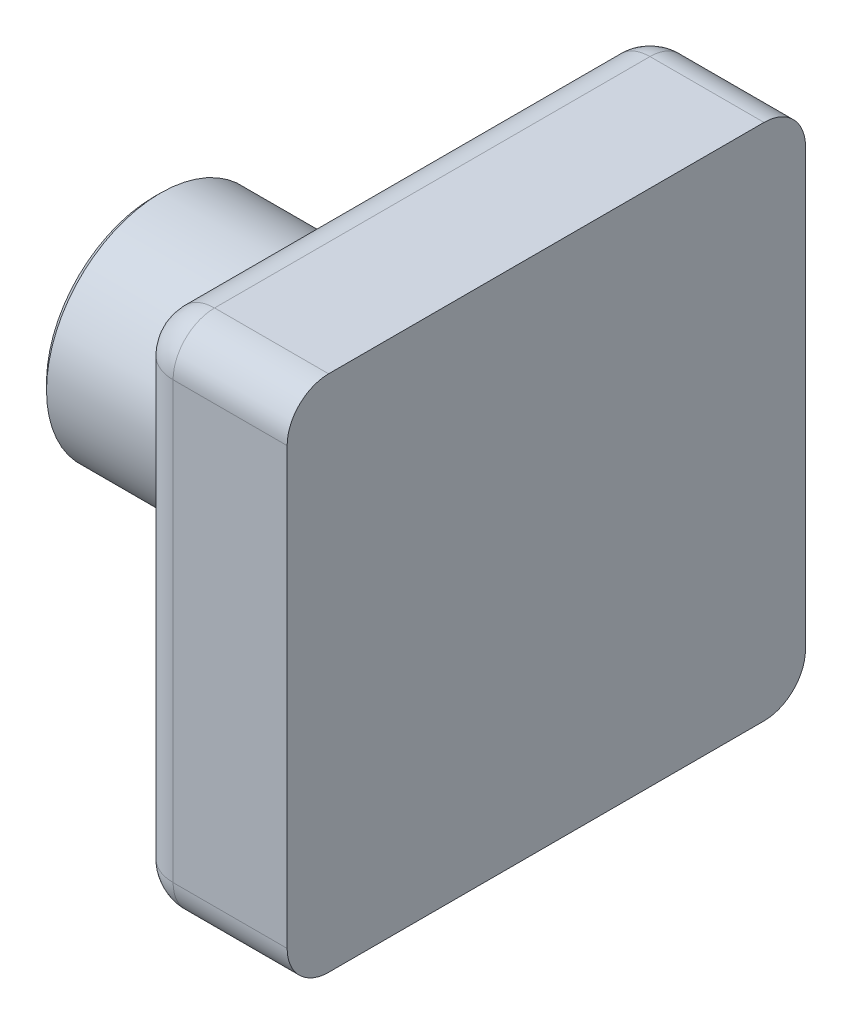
SolidWorks part; units mm, degrees
other "Markup1"
sketch "Sketch11" plane through (-32.507, 25, -25) normal (-0.9451, 0.2241, -0.238) x (-0.2709, -0.1294, 0.9539)
ref_plane "Front Plane" through (0, 0, 0) normal (0, 0, 1) x (1, 0, 0)
ref_plane "Top Plane" through (0, 0, 0) normal (0, 1, 0) x (1, 0, 0)
ref_plane "Right Plane" through (0, 0, 0) normal (1, 0, 0) x (0, 0, -1)
sketch "Sketch1" plane through (0, 0, 0) normal (0, 0, 1) x (1, 0, 0)
  line L0 (-31.75, 0) -> (31.75, 0) construction
  line L1 (31.75, -6.35) -> (31.75, 6.35) construction
  point P4 (0, 0)
  point P8 (31.75, 0)
sketch "Sketch2" plane through (0, 0, 0) normal (0, 0, 1) x (1, 0, 0)
  line L0 (-31.75, 0) -> (-31.75, 10.9855)
  line L1 (-31.75, 10.9855) -> (-8.89, 10.9855)
  line L4 (-8.89, 0) -> (-31.75, 0)
  line L5 (-8.89, 10.9855) -> (-8.89, 0)
revolve "Revolve1" add sketch "Sketch2" angle 360 about L0
sketch "Sketch6" plane through (-31.75, 0, 0) normal (-1, 0, 0) x (0, 0, 1)
  line L1 (6.35, -6.35) -> (-6.35, -6.35)
  line L2 (6.35, -6.35) -> (6.35, 6.35)
  line L3 (6.35, 6.35) -> (-6.35, 6.35)
  line L4 (-6.35, -6.35) -> (-6.35, 6.35)
  line L5 (6.35, -6.35) -> (-6.35, 6.35) construction
  line L6 (6.35, 6.35) -> (-6.35, -6.35) construction
  point P0 (0, 0)
extrude "Cut-Extrude3" cut sketch "Sketch6" against normal blind 15.24
sketch "Sketch7" plane through (-31.75, 0, 0) normal (-1, 0, 0) x (0, 0, 1)
  circle A0 centre (0, 0) radius 8.9803
extrude "Cut-Extrude4" cut sketch "Sketch7" against normal through all draft 60
chamfer "Chamfer2" distance 0.635 angle 45 4 edges at (-24.13, -6.35, 6.35) (-24.13, 6.35, 6.35) (-24.13, 6.35, -6.35) (-24.13, -6.35, -6.35)
chamfer "Chamfer3" distance 0.635 angle 45 1 edges at (-31.75, -10.9855, 0)
sketch "Sketch10" plane through (-8.89, 0, 0) normal (1, 0, 0) x (0, 0, -1)
  line L1 (25, 25) -> (-25, 25)
  line L2 (25, 25) -> (25, -25)
  line L3 (25, -25) -> (-25, -25)
  line L4 (-25, 25) -> (-25, -25)
  line L5 (25, 25) -> (-25, -25) construction
  line L6 (25, -25) -> (-25, 25) construction
  point P0 (0, 0)
  dimension "D1" = 50
  dimension "D2" = 50
extrude "Boss-Extrude2" add sketch "Sketch10" along normal blind 15
fillet "Fillet2" radius 4 9 edges at (-8.89, 0, -25) (-1.39, -25, -25) (-8.89, -25, 0) (-1.39, -25, 25) (-8.89, 0, 25) (-1.39, 25, 25) (-8.89, 25, 0) (-1.39, 25, -25) (-8.89, -10.9855, 0)
equation "\"D2@Sketch2\"=\"Square Drive Size@Sketch1\"*.865"
equation "\"D1@Sketch3\"=\"Square Drive Size@Sketch1\""
equation "\"D1@Sketch6\"=\"Square Drive Size@Sketch1\""
equation "\"D1@Cut-Extrude3\"=\"D1@Cut-Extrude1\""
equation "\"D1@Chamfer2\"=\"Square Drive Size@Sketch1\"*.05"
equation "\"D1@Fillet1\"=\"Square Drive Size@Sketch1\"*.15"
equation "\"D1@Sketch4\"=\"Square Drive Size@Sketch1\"*.95"
